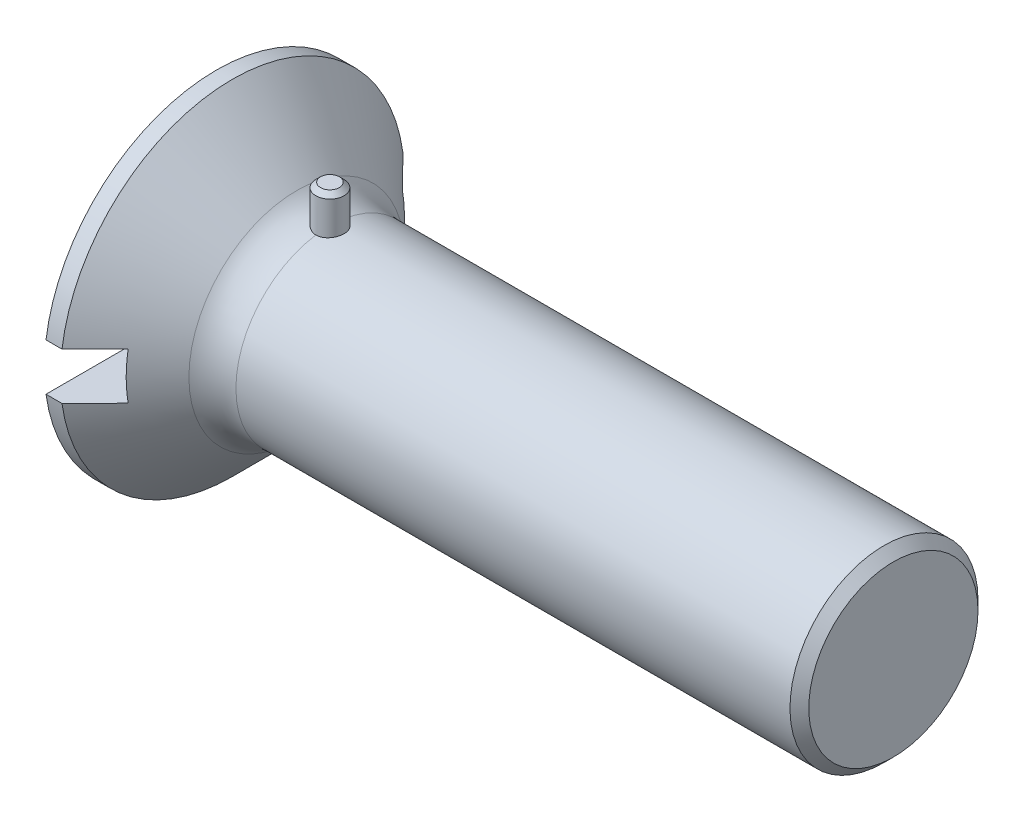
SolidWorks part; units mm, degrees
ref_plane "Plane1" through (0, 0, 0) normal (0, 0, 1) x (1, 0, 0)
ref_plane "Plane2" through (0, 0, 0) normal (0, 1, 0) x (1, 0, 0)
ref_plane "Plane3" through (0, 0, 0) normal (1, 0, 0) x (0, 0, -1)
revolve "Base-Revolve" add sketch "BodySke" angle 360 about L5
sketch "BodySke" plane through (0, 0, 0) normal (0, 0, 1) x (1, 0, 0)
  line L0 (0, 0) -> (0, 9.15)
  line L1 (0, 9.15) -> (0.85, 9.15)
  line L2 (5, 5) -> (36, 5)
  line L3 (36, 5) -> (36, 0)
  line L4 (36, 0) -> (0, 0)
  line L5 (-6.35, 0) -> (82.55, 0) construction
  line L6 (5, -5) -> (36, -5) construction
  line L7 (0.85, -9.15) -> (5, -5) construction
  line L8 (0.85, 9.15) -> (5, 5)
  line L9 (0, -9.15) -> (0.85, -9.15) construction
  line L10 (6.5, 6.5875) -> (6.5, -2.9375) construction
  line L11 (6, 6.35) -> (6, -3.175) construction
  dimension "Diameter" = 10
  dimension "Length" = 36
  dimension "Head_ht" = 5
  dimension "Head_dia" = 18.3
  dimension "Head_ang" = 90
  dimension "D6" = 0.85
  dimension "Advance" = 1.5
  dimension "Thread_nom" = 30
extrude "Slot" cut sketch "Sketch2" against normal blind 2.6
sketch "Sketch2" plane through (0, 0, 0) normal (-1, 0, 0) x (0, 0, 1)
  line L0 (-9.15, -1.25) -> (9.15, -1.25)
  line L1 (-9.15, -1.25) -> (-9.15, 1.25)
  line L2 (9.15, 1.25) -> (-9.15, 1.25)
  line L3 (9.15, 1.25) -> (9.15, -1.25)
  dimension "D1" = 1.25
  dimension "Slot_width" = 2.5
  dimension "D2" = 18.3
  dimension "D3" = 9.15
fillet "Fillet1" radius 2.5 1 edges at (5, 0, 5)
sketch "ThdSchSke" plane through (0, 0, 0) normal (0, 0, 1) x (1, 0, 0)
  line L0 (6.5, -4.172) -> (5.9202, -5)
  line L1 (6.5, -4.172) -> (7.0798, -5)
  line L2 (7.0798, -5) -> (7.0798, -6.25)
  line L3 (-3.175, 0) -> (5.1513, 0) construction
  line L5 (7.0798, -6.25) -> (5.9202, -6.25)
  line L6 (5.9202, -6.25) -> (5.9202, -5)
  line L7 (0, 9.15) -> (0, 1.25) construction
  dimension "Thread_minor" = 8.344
  dimension "Diameter" = 10
  dimension "Start" = 6.5
  dimension "SideAngle" = 55
  dimension "VeeAngle" = 70
  dimension "Overcut" = 12.5
revolve "ThreadSchematic" cut sketch "ThdSchSke" angle 360 about L3
pattern_linear "ThdSchPat"
chamfer "Chanfrein1" distance 0.5 angle 45 1 edges at (36, 0, 5)
sketch "Esquisse1" plane through (0, 0, 0) normal (0, 1, 0) x (1, 0, 0)
  line L0 (6.0355, -5) -> (6.0355, 5) construction
  circle A0 centre (6.0355, 0) radius 0.75
  dimension "D1" = 1.5
extrude "Extrusion1" add sketch "Esquisse1" along normal blind 7
chamfer "Chanfrein2" distance 0.25 angle 45 1 edges at (6.0355, 7, 0.75)
equation "\"D1@Sketch2\" = \"Slot_width@Sketch2\" / 2"
equation "\"D2@Sketch2\" = \"Head_dia@BodySke\""
equation "\"D3@Sketch2\" = \"D2@Sketch2\" / 2"
equation "\"Thread_length@ThreadCosmetic\" = ((sgn( (\"Length@BodySke\" - \"Advance@BodySke\" * 1.0 - \"Head_ht@BodySke\" ) - \"Thread_nom@BodySke\" )-1)*( (\"Length@BodySke\" - \"Advance@BodySke\" * 1.0 - \"Head_ht@BodySke\" "
equation "\"Thread_minor@ThdSchSke\" = \"Thread_minor@ThreadCosmetic\""
equation "\"Diameter@ThdSchSke\" = \"Diameter@BodySke\""
equation "\"Overcut@ThdSchSke\" = \"Diameter@BodySke\" * 1.25"
equation "\"Start@ThdSchSke\" = 0.000001 + \"Length@BodySke\" - \"Thread_length@ThreadCosmetic\"  '---Countersunk---"
equation "\"Num_threads@ThdSchPat\" = int( \"Thread_length@ThreadCosmetic\" / \"Advance@BodySke\" + 0.999 )  + 1"
equation "\"Advance@ThdSchPat\" = \"Thread_length@ThreadCosmetic\" /  (\"Num_threads@ThdSchPat\" - 1) 'relax it"
